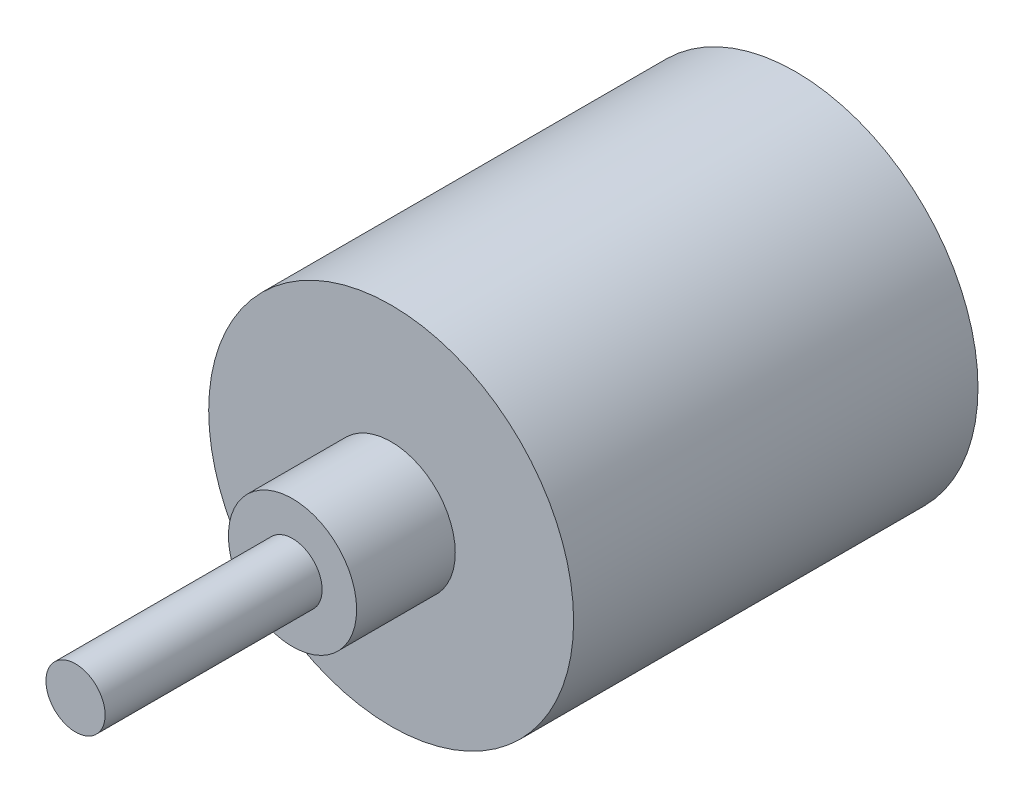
SolidWorks part; units mm, degrees
ref_plane "Front Plane" through (0, 0, 0) normal (0, 0, 1) x (1, 0, 0)
ref_plane "Top Plane" through (0, 0, 0) normal (0, 1, 0) x (1, 0, 0)
ref_plane "Right Plane" through (0, 0, 0) normal (1, 0, 0) x (0, 0, -1)
sketch "Sketch1" plane through (0, 0, 0) normal (0, 0, 1) x (1, 0, 0)
  circle A0 centre (0, 0) radius 18.5
  dimension "D1" = 37
extrude "Boss-Extrude1" add sketch "Sketch1" along normal blind 41
sketch "Sketch2" plane through (0, 0, 41) normal (0, 0, 1) x (1, 0, 0)
  circle A0 centre (0, 0) radius 6.5
extrude "Boss-Extrude2" add sketch "Sketch2" along normal blind 10
sketch "Sketch3" plane through (0, 0, 51) normal (0, 0, 1) x (1, 0, 0)
  circle A0 centre (0, 0) radius 3
extrude "Boss-Extrude3" add sketch "Sketch3" along normal blind 22
